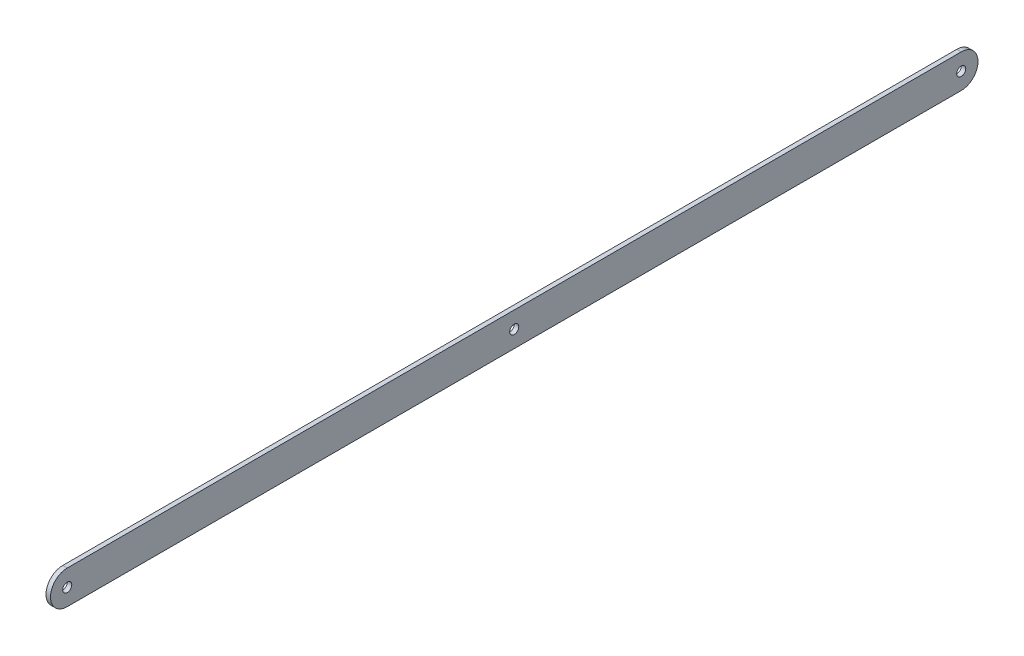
SolidWorks part; units mm, degrees
ref_plane "Piano frontale" through (0, 0, 0) normal (0, 0, 1) x (1, 0, 0)
ref_plane "Piano superiore" through (0, 0, 0) normal (0, 1, 0) x (1, 0, 0)
ref_plane "Piano destro" through (0, 0, 0) normal (1, 0, 0) x (0, 0, -1)
sketch "Schizzo1" plane through (0, 0, 0) normal (1, 0, 0) x (0, 0, -1)
  line L0 (-400, 15) -> (400, 15)
  line L1 (400, -15) -> (-400, -15)
  arc A0 (400, -15) -> (400, 15) centre (400, 0) ccw
  circle A1 centre (400, 0) radius 4.05
  arc A3 (-400, 15) -> (-400, -15) centre (-400, 0) ccw
  circle A4 centre (-400, 0) radius 4.05
  circle A5 centre (0, 0) radius 4.05
  dimension "D1" = 8.1
  dimension "D2" = 15
  dimension "D3" = 400
  dimension "D4" = 400
extrude "Estrusione-Estrusione1" add sketch "Schizzo1" along normal blind 4
